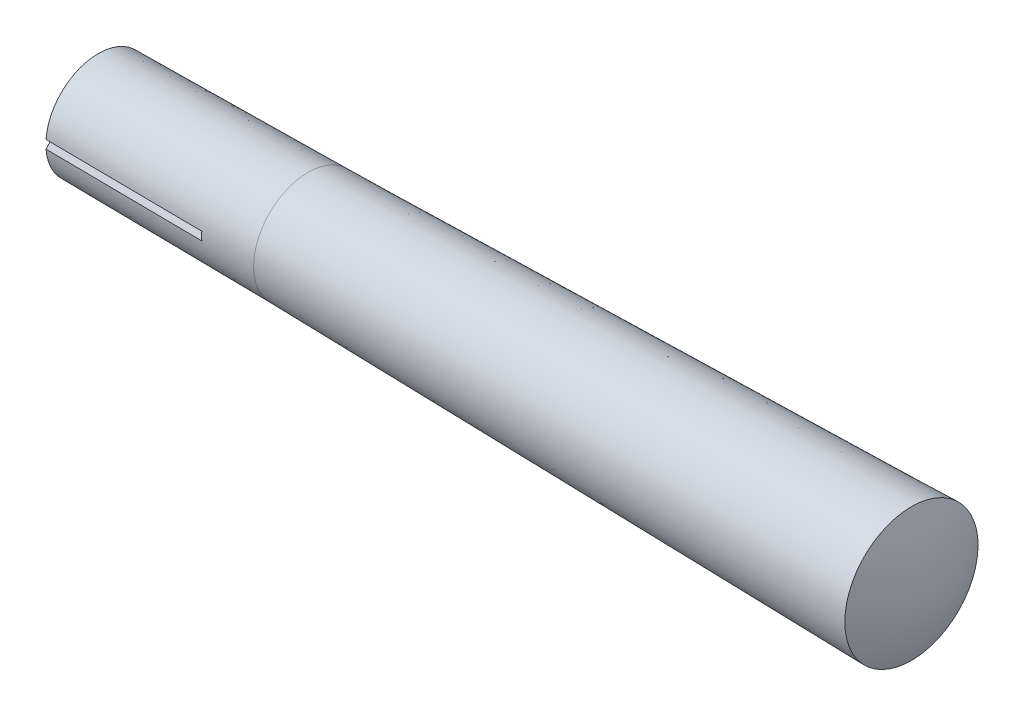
SolidWorks part; units mm, degrees
ref_plane "Front Plane" through (0, 0, 0) normal (0, 0, 1) x (1, 0, 0)
ref_plane "Top Plane" through (0, 0, 0) normal (0, 1, 0) x (1, 0, 0)
ref_plane "Right Plane" through (0, 0, 0) normal (1, 0, 0) x (0, 0, -1)
sketch "BodySke" plane through (0, 0, 0) normal (0, 0, 1) x (1, 0, 0)
  line L0 (0, 0) -> (250, 0) construction
  line L1 (0, 0) -> (250, 5) construction
  line L2 (250, 5) -> (250, 0) construction
  line L3 (0, 0) -> (0, 10) construction
  line L4 (0, 10) -> (40, 10.4)
  line L5 (40, 10.4) -> (155.01, 12.7002)
  line L7 (0, 0) -> (-21.989, 0) construction
  line L8 (0, -10) -> (40, -10.4) construction
  line L9 (40, -10.4) -> (155.01, -12.7002) construction
  line L10 (-2.5, 0) -> (157.5, 0)
  line L11 (157.5, 0) -> (157.5, 15.9181) construction
  arc A0 (0, 10) -> (-2.5, 0) centre (17.4975, 0.3131) ccw
  arc A1 (155.01, 12.7002) -> (157.5, 0) centre (123.8664, 0) cw
  dimension "D6" = 20
  dimension "D3" = 2.49
  dimension "D1" = 5
  dimension "D2" = 250
  dimension "Diameter" = 20
  dimension "Head_dia" = 20.8
  dimension "D5" = 40
  dimension "Length" = 160
  dimension "Radius_height" = 2.5
revolve "BaseBody" add sketch "BodySke" angle 360 about L0
sketch "SplSke" plane through (0, 0, 0) normal (1, 0, 0) x (0, 0, -1)
  line L0 (12.7002, 0.8) -> (12.7002, -0.8)
  line L1 (12.7002, 0.8) -> (-12.7002, 0.8)
  line L2 (-12.7002, 0.8) -> (-12.7002, -0.8)
  line L3 (12.7002, -0.8) -> (-12.7002, -0.8)
  circle A0 centre (0, 0) radius 12.7002 construction
  dimension "D1" = 0.8
  dimension "Split_Width" = 1.6
extrude "Split" cut sketch "SplSke" along normal blind 30 and the other way through all
equation "\"D1@BodySke\" = \"D2@BodySke\" / 50"
equation "\"D5@BodySke\" = \"Diameter@BodySke\" * 2"
equation "\"D6@BodySke\" = \"Diameter@BodySke\""
equation "\"D1@SplSke\" = \"Split_Width@SplSke\" / 2"
equation "\"D3@BodySke\" = \"Radius_height@BodySke\" - 0.01"
